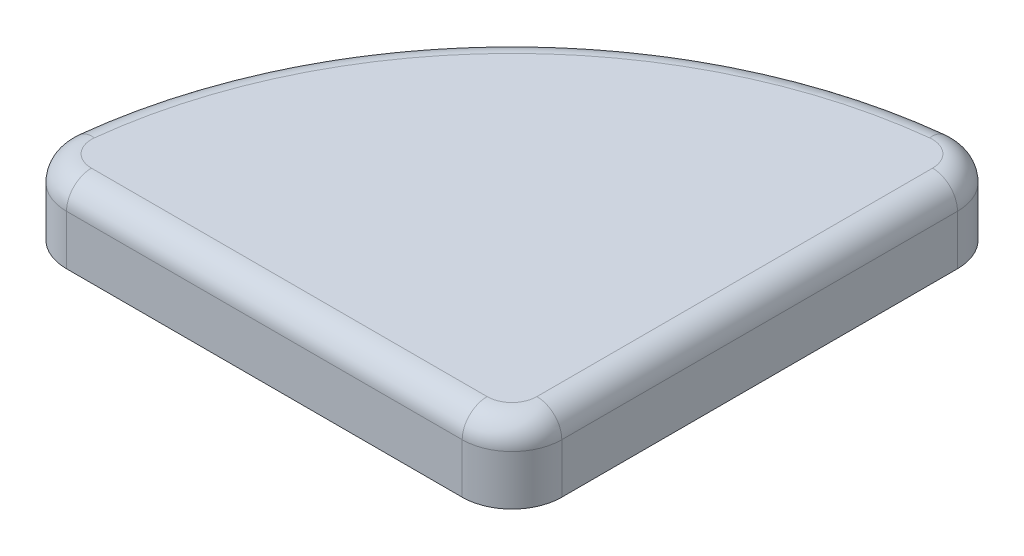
SolidWorks part; units mm, degrees
ref_plane "正面" through (0, 0, 0) normal (0, 0, 1) x (1, 0, 0)
ref_plane "平面" through (0, 0, 0) normal (0, 1, 0) x (1, 0, 0)
ref_plane "右側面" through (0, 0, 0) normal (1, 0, 0) x (0, 0, -1)
sketch "ｽｹｯﾁ1" plane through (0, 0, 0) normal (0, 1, 0) x (0, 0, -1)
  line L120 (0, 2) -> (0, 17.8885)
  line L121 (17.8885, 0) -> (2, 0)
  arc A0 (2.2222, 19.8762) -> (0, 17.8885) centre (2, 17.8885) ccw
  arc A1 (0, 2) -> (2, 0) centre (2, 2) ccw
  arc A2 (17.8885, 0) -> (19.8762, 2.2222) centre (17.8885, 2) ccw
  arc A56 (19.8762, 2.2222) -> (2.2222, 19.8762) centre (0, 0) ccw
  point P2 (0, 20)
  point P10 (20, 0)
  dimension "D1" = 20
  dimension "D2" = 20
  dimension "D3" = 2
extrude "押し出し2" add sketch "ｽｹｯﾁ1" along normal blind 3
fillet "ﾌｨﾚｯﾄ1" radius 1 6 edges at (-0.6667, 3, -19.3793) (0, 3, -9.9443) (-0.5858, 3, -0.5858) (-9.9443, 3, 0) (-19.3793, 3, -0.6667) (-14.1421, 3, -14.1421)
sketch "ｽｹｯﾁ2" plane through (0, 0, 0) normal (0, -1, 0) x (1, 0, 0)
  line L13 (-17.8885, -1.2) -> (-2, -1.2)
  line L14 (-17.8885, -1.2) -> (-2, -1.2)
  line L17 (-1.2, -2) -> (-1.2, -17.8885)
  line L18 (-1.2, -2) -> (-1.2, -17.8885)
  arc A3 (-2.0889, -18.6836) -> (-1.2, -17.8885) centre (-2, -17.8885) ccw
  arc A4 (-18.6836, -2.0889) -> (-2.0889, -18.6836) centre (0, 0) ccw
  arc A5 (-18.6836, -2.0889) -> (-2.0889, -18.6836) centre (0, 0) ccw
  arc A6 (-1.2, -2) -> (-2, -1.2) centre (-2, -2) ccw
  arc A7 (-17.8885, -1.2) -> (-18.6836, -2.0889) centre (-17.8885, -2) ccw
  dimension "D4" = 0.8
  dimension "D1" = 1.2
  dimension "D2" = 1.2
  dimension "D3" = 1.2
extrude "ｶｯﾄ - 押し出し1" cut sketch "ｽｹｯﾁ2" against normal blind 1
sketch "ｽｹｯﾁ3" plane through (0, 1, 0) normal (0, -1, 0) x (1, 0, 0)
  line L0 (-2, -1.2) -> (-17.8885, -1.2) construction
  line L1 (-12.5, -1.2) -> (-7.5, -1.2)
  line L2 (-12.5, -1.2) -> (-12.5, -2.2)
  line L3 (-12.5, -2.2) -> (-7.5, -2.2)
  line L4 (-7.5, -1.2) -> (-7.5, -2.2)
  line L5 (0, -2) -> (0, -17.8885) construction
  dimension "D1" = 1
  dimension "D2" = 5
  dimension "D3" = 7.5
extrude "ﾎﾞｽ - 押し出し1" add sketch "ｽｹｯﾁ3" along normal blind 2
sketch "ｽｹｯﾁ4" plane through (0, 1, 0) normal (0, -1, 0) x (1, 0, 0)
  line L0 (-17.8885, 0) -> (-2, 0) construction
  line L1 (-11.3, -7.85) -> (-8.7, -7.85)
  line L2 (-11.3, -7.85) -> (-11.3, -12.15)
  line L3 (-11.3, -12.15) -> (-8.7, -12.15)
  line L4 (-8.7, -7.85) -> (-8.7, -12.15)
  line L5 (0, -2) -> (0, -17.8885) construction
  dimension "D1" = 2.6
  dimension "D2" = 4.3
  dimension "D3" = 7.85
  dimension "D4" = 8.7
extrude "ﾎﾞｽ - 押し出し2" add sketch "ｽｹｯﾁ4" along normal blind 7 draft 0.5
fillet "ﾌｨﾚｯﾄ2" radius 1 4 edges at (-10, -6, -7.9111) (-8.7611, -6, -10) (-10, -6, -12.0889) (-11.2389, -6, -10)
